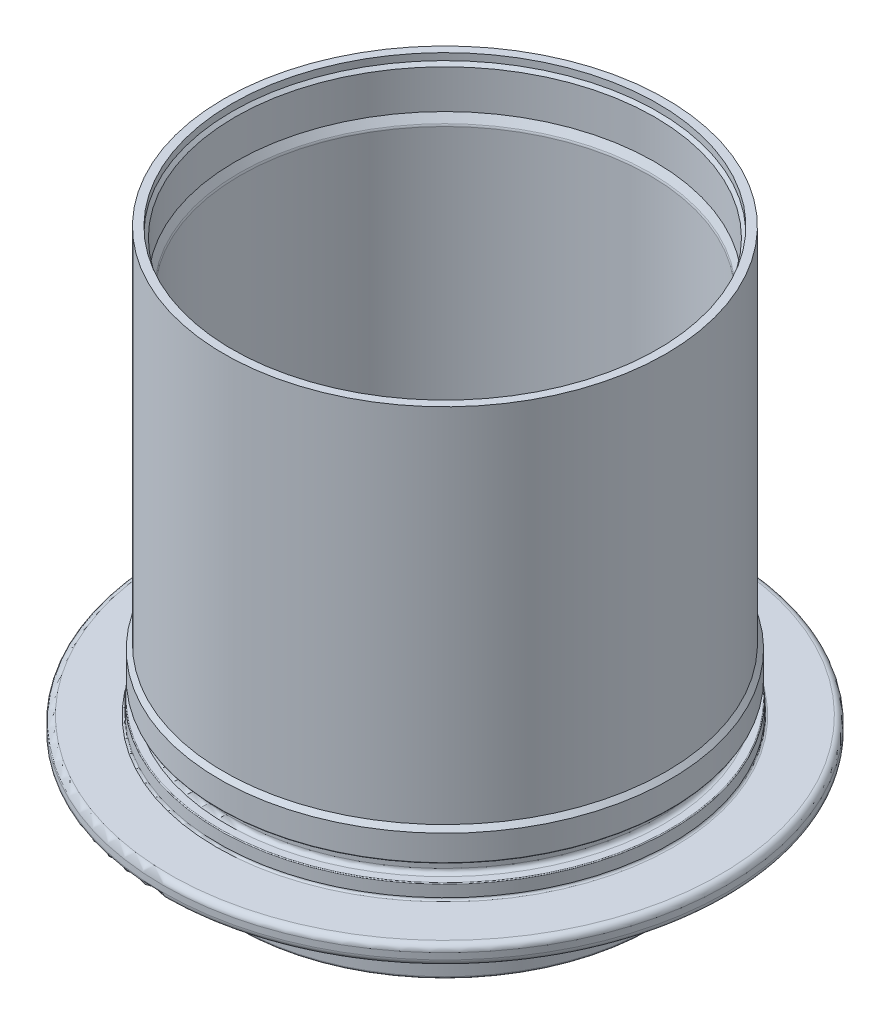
SolidWorks part; units mm, degrees
ref_plane "Plan de face" through (0, 0, 0) normal (0, 0, 1) x (1, 0, 0)
ref_plane "Plan de dessus" through (0, 0, 0) normal (0, 1, 0) x (1, 0, 0)
ref_plane "Plan de droite" through (0, 0, 0) normal (1, 0, 0) x (0, 0, -1)
sketch "Esquisse1" plane through (0, 0, 0) normal (0, 0, 1) x (1, 0, 0)
  line L0 (-120.2567, 137.3869) -> (-120.2567, 54.6295)
  line L1 (-123.5198, 150.5701) -> (-123.0582, 151.3695)
  line L2 (-111.0646, 40.4668) -> (-116.742, 46.1442)
  line L3 (-120.7707, 35.3358) -> (-119.2726, 37.9306)
  line L4 (-123.0582, 151.3695) -> (-122.3217, 151.3657)
  line L5 (-122.3217, 151.3657) -> (-122.3217, 149.8657)
  line L6 (-121.4217, 148.9657) -> (-122.3217, 149.8657)
  line L7 (-121.4217, 148.9657) -> (-121.4217, 139.6726)
  line L8 (-123.9217, 64.874) -> (-123.9217, 149.0701)
  line L9 (-125.1717, 57.524) -> (-125.1717, 63.624)
  line L10 (-125.1717, 53.374) -> (-123.4217, 53.374)
  line L11 (-137.1717, 49.874) -> (-125.8717, 49.874)
  line L12 (-138.6717, 46.874) -> (-138.6717, 48.374)
  line L13 (-119.2726, 41.6267) -> (-121.0031, 44.624)
  line L14 (-119.0717, 40.8767) -> (-119.0717, 38.6806)
  line L15 (-110.6991, 30.374) -> (-120.4717, 30.374)
  line L16 (-114.9967, 34.374) -> (-114.9967, 37.374)
  line L17 (-120.3907, 137.8869) -> (-121.4217, 139.6726)
  line L18 (-123.9217, 64.874) -> (-125.1717, 63.624)
  line L19 (-123.4217, 57.324) -> (-124.9717, 57.324)
  line L20 (-137.1717, 45.374) -> (-122.3021, 45.374)
  line L21 (-110.7717, 39.274) -> (-110.7717, 39.7597)
  line L22 (-120.9717, 30.874) -> (-120.9717, 34.5858)
  line L23 (-113.4967, 38.874) -> (-111.1717, 38.874)
  line L24 (-113.4967, 32.874) -> (-110.5217, 32.874)
  line L25 (-125.3717, 50.374) -> (-125.3717, 53.174)
  line L26 (-122.4217, 54.374) -> (-122.4217, 56.324)
  line L27 (-110.2557, 31.1419) -> (-110.6991, 30.374)
  line L28 (-110.1217, 31.6419) -> (-110.1217, 32.474)
  line L29 (-71.1717, 158.7367) -> (-71.1717, 21.124) construction
  arc A0 (-123.9217, 149.0701) -> (-123.5198, 150.5701) centre (-120.9217, 149.0701) cw
  arc A1 (-114.9967, 34.374) -> (-113.4967, 32.874) centre (-113.4967, 34.374) ccw
  arc A2 (-110.2557, 31.1419) -> (-110.1217, 31.6419) centre (-111.1217, 31.6419) ccw
  arc A3 (-110.1217, 32.474) -> (-110.5217, 32.874) centre (-110.5217, 32.474) ccw
  arc A4 (-120.4717, 30.374) -> (-120.9717, 30.874) centre (-120.4717, 30.874) cw
  arc A5 (-114.9967, 37.374) -> (-113.4967, 38.874) centre (-113.4967, 37.374) cw
  arc A6 (-110.7717, 39.7597) -> (-111.0646, 40.4668) centre (-111.7717, 39.7597) ccw
  arc A7 (-110.7717, 39.274) -> (-111.1717, 38.874) centre (-111.1717, 39.274) cw
  arc A8 (-121.0031, 44.624) -> (-122.3021, 45.374) centre (-122.3021, 43.874) ccw
  arc A9 (-119.2726, 41.6267) -> (-119.0717, 40.8767) centre (-120.5717, 40.8767) cw
  arc A10 (-119.0717, 38.6806) -> (-119.2726, 37.9306) centre (-120.5717, 38.6806) cw
  arc A11 (-120.9717, 34.5858) -> (-120.7707, 35.3358) centre (-119.4717, 34.5858) cw
  arc A12 (-137.1717, 49.874) -> (-138.6717, 48.374) centre (-137.1717, 48.374) ccw
  arc A13 (-138.6717, 46.874) -> (-137.1717, 45.374) centre (-137.1717, 46.874) ccw
  arc A14 (-125.3717, 50.374) -> (-125.8717, 49.874) centre (-125.8717, 50.374) cw
  arc A15 (-125.3717, 53.174) -> (-125.1717, 53.374) centre (-125.1717, 53.174) cw
  arc A16 (-124.9717, 57.324) -> (-125.1717, 57.524) centre (-124.9717, 57.524) cw
  arc A17 (-123.4217, 53.374) -> (-122.4217, 54.374) centre (-123.4217, 54.374) ccw
  arc A18 (-122.4217, 56.324) -> (-123.4217, 57.324) centre (-123.4217, 56.324) ccw
  arc A19 (-120.2567, 137.3869) -> (-120.3907, 137.8869) centre (-121.2567, 137.3869) ccw
  arc A20 (-116.742, 46.1442) -> (-120.2567, 54.6295) centre (-108.2567, 54.6295) cw
  dimension "D1" = 1
  dimension "D2" = 0.4
  dimension "D4" = 0.5
  dimension "D7" = 1.5
  dimension "D8" = 1.5
  dimension "D12" = 1
  dimension "D13" = 0.4
  dimension "D19" = 1.5
  dimension "D20" = 1.5
  dimension "D21" = 0.5
  dimension "D25" = 0.2
  dimension "D26" = 1
  dimension "D36" = 3
  dimension "D37" = 1
  dimension "D39" = 12
  dimension "D3" = 10.85
  dimension "D5" = 30
  dimension "D6" = 1.9
  dimension "D9" = 2.5
  dimension "D10" = 6
  dimension "D11" = 0.65
  dimension "D14" = 30
  dimension "D15" = 30
  dimension "D16" = 15
  dimension "D17" = 17.7
  dimension "D18" = 4.5
  dimension "D22" = 2.95
  dimension "D23" = 4.4
  dimension "D24" = 13.5
  dimension "D27" = 15
  dimension "D28" = 14.75
  dimension "D29" = 1.6
  dimension "D30" = 1.5
  dimension "D31" = 45
  dimension "D32" = 2.5
  dimension "D33" = 3.665
  dimension "D34" = 30
  dimension "D35" = 30
  dimension "D38" = 45
  dimension "D40" = 67.5
revolve "Révolution1" add sketch "Esquisse1" angle 360 about L29
ref_plane "Plan1" through (0, 64.874, 0) normal (0, 1, 0) x (1, 0, 0)
sketch "Esquisse3" plane through (0, 64.874, 0) normal (0, 1, 0) x (1, 0, 0)
  line L0 (-71.1717, 0) -> (-71.1717, -78.1645) construction
  line L1 (-71.1717, -78.1645) -> (-71.1717, 0) construction
  line L2 (-18.764, 6) -> (-22.3444, 5.0236)
  line L3 (-71.1717, 0) -> (-8.6129, 0) construction
  line L4 (-50.164, -48.3864) -> (-51.1086, -44.7974)
  line L5 (-39.7717, -42.3864) -> (-42.4075, -39.7739)
  line L6 (-18.764, -6) -> (-22.3444, -5.0236)
  line L7 (-102.5717, -42.3864) -> (-99.9359, -39.7739)
  line L8 (-92.1794, -48.3864) -> (-91.2348, -44.7974)
  line L9 (-123.5793, 6) -> (-119.9989, 5.0236)
  line L10 (-123.5793, -6) -> (-119.9989, -5.0236)
  line L11 (-92.1794, 48.3864) -> (-91.2348, 44.7974)
  line L12 (-102.5717, 42.3864) -> (-99.9359, 39.7739)
  line L13 (-39.7717, 42.3864) -> (-42.4075, 39.7739)
  line L14 (-50.164, 48.3864) -> (-51.1086, 44.7974)
  arc A0 (-119.9989, -5.0236) -> (-99.9359, -39.7739) centre (-71.1717, 0) ccw
  arc A1 (-92.1794, -48.3864) -> (-50.164, -48.3864) centre (-71.1717, 0) ccw
  arc A2 (-123.5793, -6) -> (-102.5717, -42.3864) centre (-71.1717, 0) ccw
  arc A3 (-91.2348, -44.7974) -> (-51.1086, -44.7974) centre (-71.1717, 0) ccw
  arc A4 (-39.7717, -42.3864) -> (-18.764, -6) centre (-71.1717, 0) ccw
  arc A5 (-42.4075, -39.7739) -> (-22.3444, -5.0236) centre (-71.1717, 0) ccw
  arc A6 (-18.764, 6) -> (-39.7717, 42.3864) centre (-71.1717, 0) ccw
  arc A7 (-22.3444, 5.0236) -> (-42.4075, 39.7739) centre (-71.1717, 0) ccw
  arc A8 (-51.1086, 44.7974) -> (-91.2348, 44.7974) centre (-71.1717, 0) ccw
  arc A9 (-50.164, 48.3864) -> (-92.1794, 48.3864) centre (-71.1717, 0) ccw
  arc A10 (-99.9359, 39.7739) -> (-119.9989, 5.0236) centre (-71.1717, 0) ccw
  arc A11 (-102.5717, 42.3864) -> (-123.5793, 6) centre (-71.1717, 0) ccw
  point P31 (-71.1717, 0)
  point P34 (-71.1717, 0)
  dimension "D3" = 105.5
  dimension "D4" = 98.17
  dimension "D1" = 15.254
  dimension "D2" = 6
  dimension "D5" = 6
extrude "Enlèv. mat.-Extru.2" [suppressed] cut sketch "Esquisse3" along normal blind 52
fillet "Congé1" [suppressed] radius 9
fillet "Congé2" [suppressed] radius 12
hole_wizard "Fraisage pour vis à tête fraisée M51" positions "Esquisse5" profile "Esquisse4" countersink size "M5" standard "Iso"
sketch "Esquisse5" plane through (0, 45.374, 0) normal (0, -1, 0) x (-1, 0, 0)
  circle A0 centre (71.1717, 0) radius 45.5703 construction
  point P0 (11.9217, 0)
  dimension "D1" = 59.25
sketch "Esquisse4" plane through (-11.9217, 45.374, 0) normal (1, 0, 0) x (0, 0, -1)
  line L0 (0, 0) -> (0, 105.9955)
  line L1 (0, 105.9955) -> (2.75, 105.9955)
  line L2 (2.75, 105.9955) -> (2.75, 3.25)
  line L3 (2.75, 3.25) -> (6, 0)
  line L5 (6, 0) -> (0, 0)
  line L6 (-2.75, 3.25) -> (-6, 0) construction
  line L11 (0, -6.35) -> (0, 107.95) construction
  dimension "Diamètre du perçage jusqu'au prochain" = 5.5
  dimension "Profondeur du perçage jusqu'au prochain" = 105.9955
  dimension "Diamètre du fraisage entrant" = 12
  dimension "Angle du fraisage entrant" = 90
pattern_circular "Répétition circulaire1" [suppressed] count 8 over 360
ref_plane "Plan3" through (0, 151.374, 0) normal (0, 1, 0) x (1, 0, 0)
sketch "Esquisse6" plane through (0, 151.374, 0) normal (0, 1, 0) x (1, 0, 0)
  circle A0 centre (-71.1717, 0) radius 51
  circle A1 centre (-71.1717, 0) radius 52.95
extrude "Boss.-Extru.1" add sketch "Esquisse6" against normal blind 90
